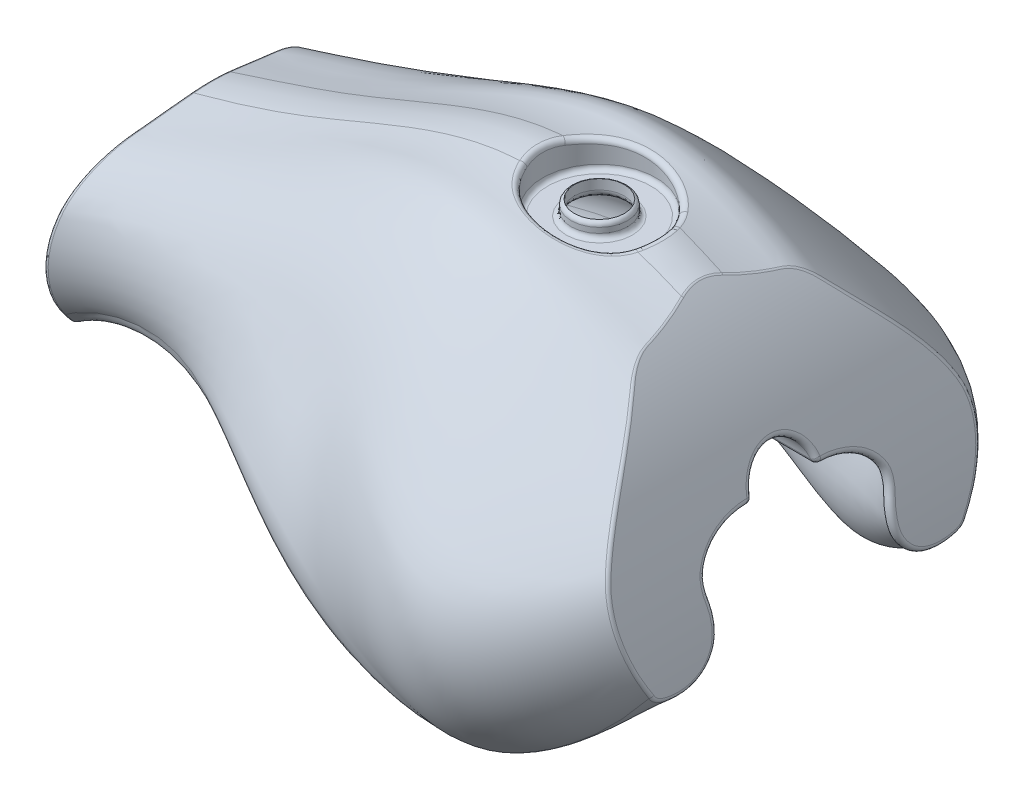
SolidWorks part; units mm, degrees
ref_plane "Front Plane" through (0, 0, 0) normal (0, 0, 1) x (1, 0, 0)
ref_plane "Top Plane" through (0, 0, 0) normal (0, 1, 0) x (1, 0, 0)
ref_plane "Right Plane" through (0, 0, 0) normal (1, 0, 0) x (0, 0, -1)
ref_plane "Plane1" through (-102, 0, 0) normal (1, 0, 0) x (0, 0, -1)
ref_plane "Plane2" through (-204, 0, 0) normal (1, 0, 0) x (0, 0, -1)
ref_plane "Plane3" through (-382, 0, 0) normal (1, 0, 0) x (0, 0, -1)
ref_plane "Plane4" through (-513, 0, 0) normal (1, 0, 0) x (0, 0, -1)
sketch "Sketch8" plane through (0, 0, 0) normal (1, 0, 0) x (0, 0, -1)
  line L0 (0, 62.9793) -> (61.6, 51.0055)
  line L1 (0, 0) -> (0, 122.8263) construction
  line L2 (0, 0) -> (-200.0366, 0) construction
  arc A0 (61.6, 51.0055) -> (123.3722, -69.5381) centre (45.1713, -33.5126) cw
  arc A10 (123.3722, -69.5381) -> (115.7498, -77.3071) centre (111.6077, -65.6194) cw
  arc A11 (115.7498, -77.3071) -> (53.6881, -39.0791) centre (100.1168, -33.1953) cw
  arc A13 (53.6881, -39.0791) -> (51.1155, -23.151) centre (-181.233, -68.8502) ccw
  arc A15 (51.1155, -23.151) -> (12.6, 0) centre (21.3851, -28.9985) ccw
  dimension "D3" = 86.1
  dimension "D4" = 12.4
  dimension "D5" = 46.8
  dimension "D6" = 236.8
  dimension "D7" = 30.3
  dimension "D1" = 79
  dimension "D2" = 61.6
  dimension "D8" = 12.6
sketch "Sketch17" plane through (-102, 0, 0) normal (1, 0, 0) x (0, 0, -1)
  line L0 (0, 0) -> (0, 122.8263) construction
  line L1 (0, 0) -> (-200.0366, 0) construction
  arc A0 (0, 116.4934) -> (54.8182, 107.3811) centre (83.0075, 446.4112) ccw
  arc A1 (54.8182, 107.3811) -> (77.6642, 99.0787) centre (50.9818, 61.2403) cw
  arc A2 (77.6642, 99.0787) -> (175.7854, 8.3633) centre (-214.8628, -315.7535) cw
  arc A3 (175.7854, 8.3633) -> (180.9465, 1.6619) centre (86.1272, -66.0252) cw
  arc A4 (180.9465, 1.6619) -> (162.6442, -135.1139) centre (98.824, -56.9615) cw
  arc A5 (162.6442, -135.1139) -> (153.3782, -141.3781) centre (123.4287, -87.0917) cw
  arc A6 (153.3782, -141.3781) -> (135.5469, -137.5517) centre (146.6637, -129.2074) cw
  arc A7 (123.9854, -92.0349) -> (135.5469, -137.5517) centre (184.3329, -100.933) ccw
  arc A8 (123.9854, -92.0349) -> (133.3955, -52.0895) centre (363.199, -127.3064) cw
  arc A9 (133.3955, -52.0895) -> (137.259, -31.5684) centre (56.9844, -27.0794) ccw
  arc A10 (137.259, -31.5684) -> (116.5339, -4.3888) centre (111, -30.1) ccw
  arc A11 (116.5339, -4.3888) -> (12.6, 0) centre (51.7679, -305.2978) ccw
  dimension "D1" = 340.2
  dimension "D2" = 46.3
  dimension "D3" = 507.6
  dimension "D4" = 116.5
  dimension "D5" = 100.9
  dimension "D6" = 13.9
  dimension "D7" = 61
  dimension "D8" = 241.8
  dimension "D9" = 80.4
  dimension "D10" = 26.3
  dimension "D11" = 307.8
  dimension "D12" = 12.6
  dimension "D13" = 30.1
  dimension "D14" = 98.4
sketch "Sketch26" plane through (-204, 0, 0) normal (1, 0, 0) x (0, 0, -1)
  line L0 (0, 0) -> (0, 122.8263) construction
  line L1 (0, 0) -> (-200.0366, 0) construction
  arc A0 (0, 139.7) -> (52.5603, 132.1164) centre (52.6277, 318.5163) ccw
  arc A1 (52.5603, 132.1164) -> (71.9143, 126.0833) centre (52.5479, 98.0164) cw
  arc A2 (71.9143, 126.0833) -> (184.8584, -65.0463) centre (-78.3033, -91.6205) cw
  arc A3 (184.8584, -65.0463) -> (159.992, -108.5307) centre (141.9765, -69.3765) cw
  arc A4 (159.992, -108.5307) -> (143.9305, -105.5859) centre (154.0565, -95.6307) cw
  arc A5 (143.9305, -105.5859) -> (118.7993, -43.6475) centre (206.3977, -44.1724) cw
  arc A6 (118.7993, -43.6475) -> (84.0355, -2.6204) centre (77.5, -43.4) ccw
  arc A7 (84.0355, -2.6204) -> (12.6, 0) centre (37.6537, -292.0273) ccw
  dimension "D1" = 186.4
  dimension "D2" = 34.1
  dimension "D3" = 264.5
  dimension "D4" = 43.1
  dimension "D5" = 14.2
  dimension "D6" = 87.6
  dimension "D7" = 41.3
  dimension "D8" = 293.1
  dimension "D9" = 139.7
  dimension "D10" = 12.6
  dimension "D11" = 43.4
  dimension "D12" = 77.5
sketch "Sketch34" plane through (-382, 0, 0) normal (1, 0, 0) x (0, 0, -1)
  line L0 (0, 0) -> (0, 122.8263) construction
  line L1 (0, 0) -> (-200.0366, 0) construction
  line L2 (16.5, 0) -> (12.6, 0)
  line L3 (0, 82.4018) -> (0, 67.4106) construction
  line L4 (12.6, 82.4018) -> (12.6, 67.4106) construction
  line L5 (12.6, 79.9) -> (4.6686, 79.9) construction
  arc A0 (0, 82.4018) -> (48.2766, 73.8234) centre (181.2056, 962.0314) ccw
  arc A1 (48.2766, 73.8234) -> (110.9504, -41.4678) centre (36.1101, -7.4713) cw
  arc A2 (16.5, 0) -> (81.4952, -41.5637) centre (16.5, -71.6) cw
  arc A7 (110.9504, -41.4678) -> (81.4952, -41.5637) centre (96.2009, -34.7678) cw
  dimension "D1" = 898.1
  dimension "D2" = 82.2
  dimension "D3" = 16.2
  dimension "D4" = 71.6
  dimension "D5" = 3.9
  dimension "D7" = 12.6
  dimension "D9" = 79.9
  dimension "D8" = 12.6
sketch "Sketch42" plane through (-513, 0, 0) normal (1, 0, 0) x (0, 0, -1)
  line L0 (0, 0) -> (0, 122.8263) construction
  line L1 (0, 0) -> (-200.0366, 0) construction
  arc A0 (0, 39.2) -> (61.474, 27.8852) centre (-68.2445, -504.2317) cw
  arc A1 (61.474, 27.8852) -> (98.1111, -12.7159) centre (49.9635, -19.332) cw
  arc A4 (98.1111, -12.7159) -> (68.7629, -100.0445) centre (-4.5245, -26.8194) cw
  arc A5 (68.7629, -100.0445) -> (52.1644, -97.1658) centre (61.4766, -92.7644) cw
  arc A6 (52.1644, -97.1658) -> (37.9009, -16.8301) centre (192.5711, -30.8027) cw
  arc A7 (37.9009, -16.8301) -> (29.3921, -3.8428) centre (25.4516, -15.7054) ccw
  arc A8 (29.3921, -3.8428) -> (12.6, 0) centre (0.9887, -89.3487) ccw
  dimension "D1" = 547.7
  dimension "D2" = 48.6
  dimension "D3" = 103.6
  dimension "D4" = 10.3
  dimension "D5" = 155.3
  dimension "D6" = 12.5
  dimension "D7" = 90.1
  dimension "D8" = 12.6
  dimension "D9" = 39.2
surface "Surface-Loft2"
mirror "Mirror2" about plane through (0, 0, 0) normal (0, 0, 1)
surface "Surface-Knit3"
sketch "Sketch43" plane through (0, 0, 0) normal (1, 0, 0) x (0, 0, -1)
  arc A0 (-10.8494, -22.9663) -> (5.8326, -24.7213) centre (0, 0) cw
  dimension "D1" = 25.4
surface "Surface-Extrude1" sketch "Sketch43" parameters "D1"=699.516
surface "Surface-Trim4"
sketch "Sketch44" plane through (0, 0, 0) normal (0, 0, 1) x (1, 0, 0)
  line L0 (-513, -103.0644) -> (-513, -2.5818) construction
  line L1 (-513, -103.0644) -> (-513, -2.5818) construction
  arc A0 (-513, -103.0509) -> (-468.9378, 53.0728) centre (-132.698, -126.1025) cw
  spline S0 degree 3 poles (-513, 39.2) (-483.9278, 48.92) (-358.6495, 84.0055) (-228.6378, 156.4894) (-100.7082, 120.9207) (-21.5571, 77.8215) (0, 62.9793) knots 0 0 0 0 0.251546 0.589176 0.784881 1 1 1 1 construction
  dimension "D1" = 381
surface "Surface-Extrude2" sketch "Sketch44" parameters "D1"=553.72
surface "Surface-Trim2"
sketch "Sketch45" plane through (0, 0, 0) normal (0, 0, 1) x (1, 0, 0)
  line L0 (0, -79.9951) -> (0, 1.037) construction
  arc A0 (0, -79.9987) -> (-90.3603, 111.531) centre (-303.8658, -106.2771) ccw
  spline S0 degree 3 poles (-468.9378, 53.0728) (-442.4609, 61.3033) (-342.1911, 93.1813) (-228.6378, 156.4894) (-100.7082, 120.9207) (-21.5571, 77.8215) (0, 62.9793) knots 0 0 0 0 0.152187 0.489817 0.685521 0.90064 0.90064 0.90064 0.90064 construction
  dimension "D1" = 305
surface "Surface-Extrude3" sketch "Sketch45" parameters "D1"=553.72
surface "Surface-Trim3"
ref_plane "Plane5" through (0, 187.96, 0) normal (0, 1, 0) x (-1, 0, 0)
fillet "Fillet5" radius 3.8 10 edges at (-491.3127, 2.5695, -96.3781) (-480.6027, 29.2143, 79.4415) (-512.8107, -100.1153, 54.4823) (-482.2994, 25.3565, 1.4866) (-41.3792, 49.0477, -107.1351) (-1.4111, -66.9565, -69.0106) (-28.7126, 25.3119, 2.1134) (-1.2294, -68.3798, 70.3117) (-13.5009, -12.9327, 141.8039) (-512.2676, -93.119, -50.803)
fillet "Fillet6" radius 89 3 edges at (-89.8637, 111.0338, 0) (-468.7244, 52.8357, 0)
sketch "Sketch52" plane through (0, 187.96, 0) normal (0, 1, 0) x (-1, 0, 0)
  circle A0 centre (165.1, 0) radius 44.45
  dimension "D1" = 88.9
  dimension "D2" = 165.1
surface "Surface-Extrude4" sketch "Sketch52" parameters "D1"=76
surface "Surface-Trim5"
surface "Surface-Trim6"
surface "Surface-Plane1"
sketch "Sketch53" plane through (0, 111.96, 0) normal (0, 1, 0) x (1, 0, 0)
  circle A0 centre (-165.1, 0) radius 22.225
  dimension "D1" = 44.45
surface "Surface-Extrude5" sketch "Sketch53" parameters "D1"=11.5
surface "Surface-Trim7"
surface "Surface-Knit4"
fillet "Fillet7" radius 3.8 2 edges at (-165.1, 111.96, 22.225) (-165.1, 111.96, 44.45)
fillet "Fillet8" radius 3.8 4 edges at (-120.7015, 121.5679, -2.1392) (-209.4033, 136.9104, 3.6085) (-161.5175, 127.772, 44.3054) (-166.7393, 128.8159, -44.4198)
fillet "Fillet9" radius 3.8 6 edges at (-491.13, -1.957, -25.9146) (-21.2267, 2.9134, -25.7542) (-21.2267, 2.9134, 25.7542) (-491.13, -1.957, 25.9146) (-391.4088, -0.6684, -25.3912) (-344.7684, -0.3365, 25.3978)
thicken "Thicken2" surfaces to thicken 130 thickness 2.54 parameters "D1"=2.54
sketch "Sketch51" plane through (0, 187.96, 0) normal (0, 1, 0) x (-1, 0, 0)
  circle A0 centre (161.6692, 0) radius 15.875
  dimension "D1" = 31.75
ref_plane "Plane6" through (0, 203, 0) normal (0, 1, 0) x (-1, 0, 0)
fillet "Fillet10" radius 3.8 1 edges at (-165.1, 123.46, 22.225)
